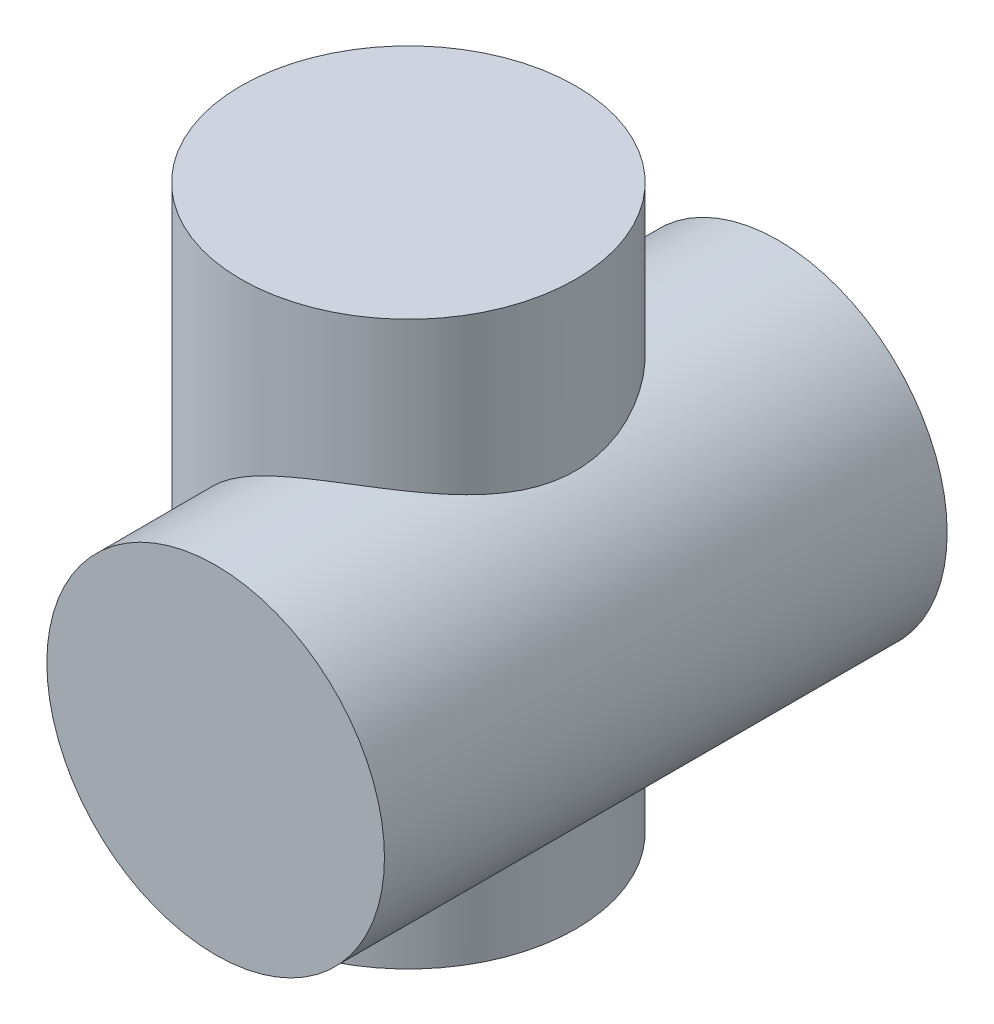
SolidWorks part; units mm, degrees
ref_plane "前视基准面" through (0, 0, 0) normal (0, 0, 1) x (1, 0, 0)
ref_plane "上视基准面" through (0, 0, 0) normal (0, 1, 0) x (1, 0, 0)
ref_plane "右视基准面" through (0, 0, 0) normal (1, 0, 0) x (0, 0, -1)
sketch "草图1" plane through (0, 0, 0) normal (0, 0, 1) x (1, 0, 0)
  circle A0 centre (0, 0) radius 15
  dimension "D1" = 30
extrude "拉伸1" add sketch "草图1" along normal blind 50
ref_plane "基准面1" through (0, 3, 0) normal (0, 1, 0) x (-1, 0, 0)
sketch "草图2" plane through (0, 3, 0) normal (0, 1, 0) x (-1, 0, 0)
  line L0 (0, 25) -> (31.6657, 25) construction
  line L1 (15, 50) -> (-15, 50) construction
  line L2 (7.8768, 7.872) -> (7.8768, 65.917) construction
  circle A0 centre (7.8768, 25) radius 14.8792
  point P6 (7.8768, 25)
  point P7 (7.8768, 25)
  dimension "D1" = 25
extrude "拉伸2" add sketch "草图2" along normal mid plane 50
